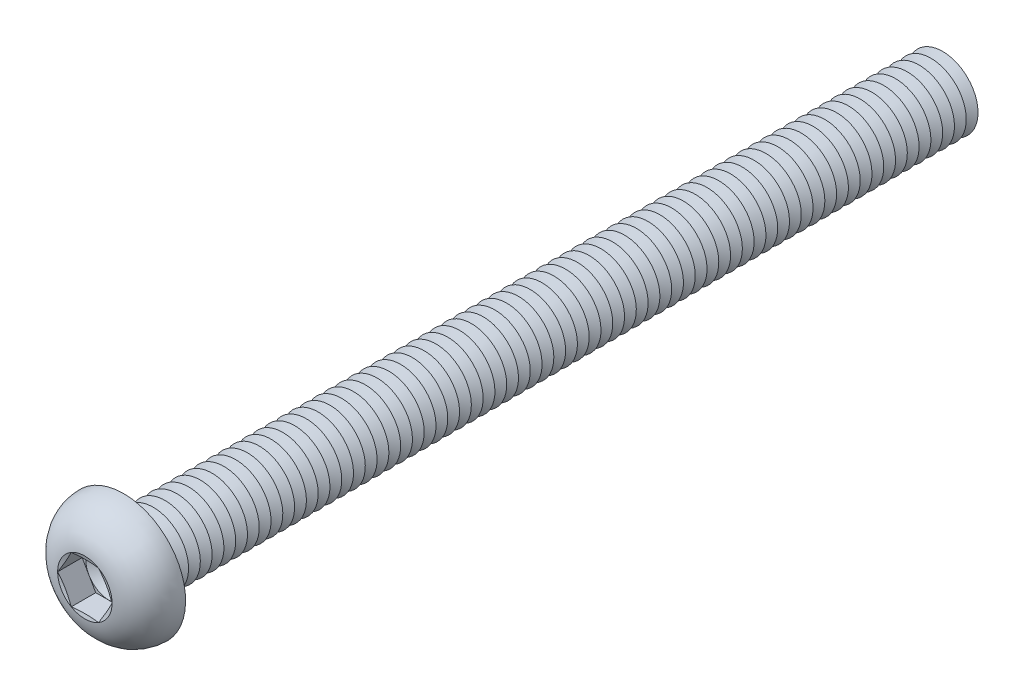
SolidWorks part; units mm, degrees
ref_plane "Front Plane" through (0, 0, 0) normal (0, 0, 1) x (1, 0, 0)
ref_plane "Top Plane" through (0, 0, 0) normal (0, 1, 0) x (1, 0, 0)
ref_plane "Right Plane" through (0, 0, 0) normal (1, 0, 0) x (0, 0, -1)
sketch "Sketch1" plane through (0, 0, 0) normal (1, 0, 0) x (0, 0, -1)
  line L0 (0, 3) -> (0, 5.25)
  line L3 (0, 3) -> (70, 3)
  line L4 (70, 3) -> (70, 0)
  line L5 (70, 0) -> (-3.3, 0) construction
  line L6 (-3.3, 0) -> (70, 0)
  line L7 (-3.3, 2.3094) -> (-3.3, 1.1547) construction
  line L8 (-3.3, 1.1547) -> (-3.3, 0)
  line L9 (-3.3, 2.3094) -> (-2.9906, 1.1547)
  line L10 (-2.9906, 1.1547) -> (-3.3, 1.1547)
  line L11 (70, 0) -> (22.7481, 0) construction
  line L12 (0, 5.25) -> (-3.3, 5.25) construction
  arc A1 (0, 5.25) -> (-3.3, 2.3094) centre (0, 1.928) ccw
  point P8 (70, 1.5)
  dimension "D1" = 10.5
  dimension "D2" = 6
  dimension "D3" = 3.3
  dimension "D4" = 4.6188
  dimension "D5" = 70
  dimension "D6" = 15
revolve "Revolve1" add sketch "Sketch1" angle 360 about L5
fillet "Fillet1" radius 0.5 1 edges at (0, 3, 0)
sketch "Sketch2" plane through (0, 0, 0) normal (1, 0, 0) x (0, 0, -1)
  line L0 (69.5, 3) -> (70.5, 3)
  line L1 (70, 3) -> (0.5, 3) construction
  line L2 (70.5, 3) -> (70, 2.134)
  line L3 (70, -3) -> (70, 3) construction
  line L4 (70, 2.134) -> (69.5, 3)
  dimension "D1" = 1
revolve "Cut-Revolve1" cut sketch "Sketch2" angle 360 about axis through (0, 0, -70) along (0, 0, -1)
pattern_linear "LPattern1" count 70 spacing 1 along (0, 0, 1) of "Cut-Revolve1"
sketch "Sketch3" plane through (0, 0, 3.3) normal (0, 0, 1) x (1, 0, 0)
  line L7 (1.1547, 2) -> (-1.1547, 2)
  line L8 (-1.1547, 2) -> (-2.3094, 0)
  line L9 (-2.3094, 0) -> (-1.1547, -2)
  line L10 (-1.1547, -2) -> (1.1547, -2)
  line L11 (1.1547, -2) -> (2.3094, 0)
  line L12 (2.3094, 0) -> (1.1547, 2)
  circle A0 centre (0, 0) radius 2 construction
  circle A3 centre (0, 0) radius 2.3094 construction
extrude "Cut-Extrude1" cut sketch "Sketch3" against normal blind 2.08
sketch "Sketch4" plane through (0, 0, 1.22) normal (0, 0, 1) x (1, 0, 0)
  line L1 (1.1547, 2) -> (-1.1547, 2) construction
  circle A0 centre (0, 0) radius 2
extrude "Cut-Extrude2" cut sketch "Sketch4" against normal through all draft 60
